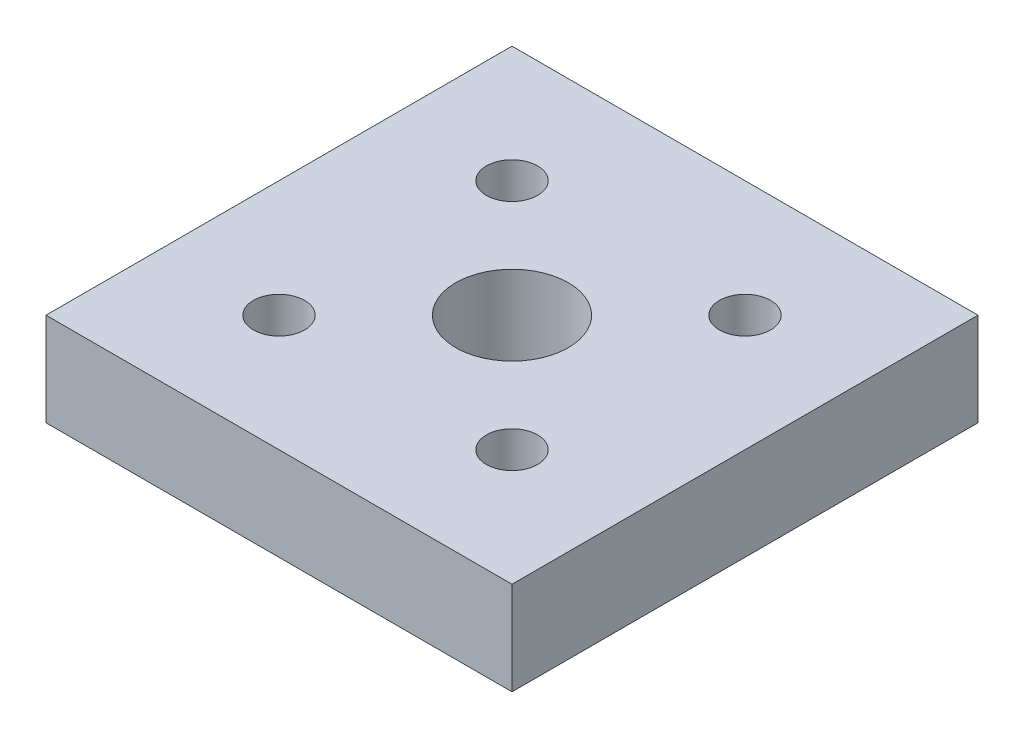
SolidWorks part; units mm, degrees
ref_plane "正面" through (0, 0, 0) normal (0, 0, 1) x (1, 0, 0)
ref_plane "平面" through (0, 0, 0) normal (0, 1, 0) x (1, 0, 0)
ref_plane "右側面" through (0, 0, 0) normal (1, 0, 0) x (0, 0, -1)
sketch "ｽｹｯﾁ1" plane through (0, 0, 0) normal (0, 1, 0) x (1, 0, 0)
  line L1 (0, 0) -> (60, 0)
  line L2 (0, 0) -> (0, 60)
  line L3 (0, 60) -> (60, 60)
  line L4 (60, 0) -> (60, 60)
  dimension "D1" = 60
  dimension "D2" = 60
extrude "押し出し1" add sketch "ｽｹｯﾁ1" along normal blind 12
hole_wizard "M16x1.5 ねじ穴1" positions "3Dｽｹｯﾁ2" profile "ｽｹｯﾁ8" tap size "M16x1.5" standard "JIS"
sketch3d "3Dｽｹｯﾁ2"
  line L0 (0, 0, -60) -> (0, 0, 0) construction
  line L1 (60, 0, -60) -> (0, 0, -60) construction
  point P0 (30, 0, -30)
  dimension "D1" = 30
  dimension "D2" = 30
sketch "ｽｹｯﾁ8" plane through (30, 0, -30) normal (1, 0, 0) x (0, 0, -1)
  line L0 (0, 0) -> (0, 12)
  line L1 (0, 12) -> (7.25, 12)
  line L2 (7.25, 12) -> (7.25, 0)
  line L5 (7.25, 0) -> (0, 0)
  line L11 (0, -6.35) -> (0, 107.95) construction
  dimension "次ｻｰﾌｪｽまでのねじ下穴ﾄﾞﾘﾙ直径" = 14.5
  dimension "次ｻｰﾌｪｽまでのねじ下穴ﾄﾞﾘﾙの深さ" = 12
hole_wizard "穴1" positions "3Dｽｹｯﾁ4" profile "ｽｹｯﾁ9" legacy
sketch3d "3Dｽｹｯﾁ4"
  line L0 (0, 0, -60) -> (0, 0, 0) construction
  line L1 (60, 0, -60) -> (0, 0, -60) construction
  point P0 (15, 0, -15)
  point P2 (45, 0, -15)
  point P4 (45, 0, -45)
  point P6 (15, 0, -45)
  dimension "D1" = 15
  dimension "D2" = 30
  dimension "D3" = 15
  dimension "D4" = 30
sketch "ｽｹｯﾁ9" plane through (15, 0, -15) normal (1, 0, 0) x (0, 0, -1)
  line L0 (0, 0) -> (0, 12)
  line L1 (0, 12) -> (3.3, 12)
  line L2 (3.3, 12) -> (3.3, 6.5)
  line L3 (3.3, 6.5) -> (5.5, 6.5)
  line L4 (5.5, 6.5) -> (5.5, 0)
  line L5 (5.5, 0) -> (0, 0)
  line L6 (0, 110) -> (0, -10) construction
  dimension "直径" = 6.6
  dimension "深さ" = 12
  dimension "座ぐり穴-直径" = 11
  dimension "座ぐり穴-深さ" = 6.5
